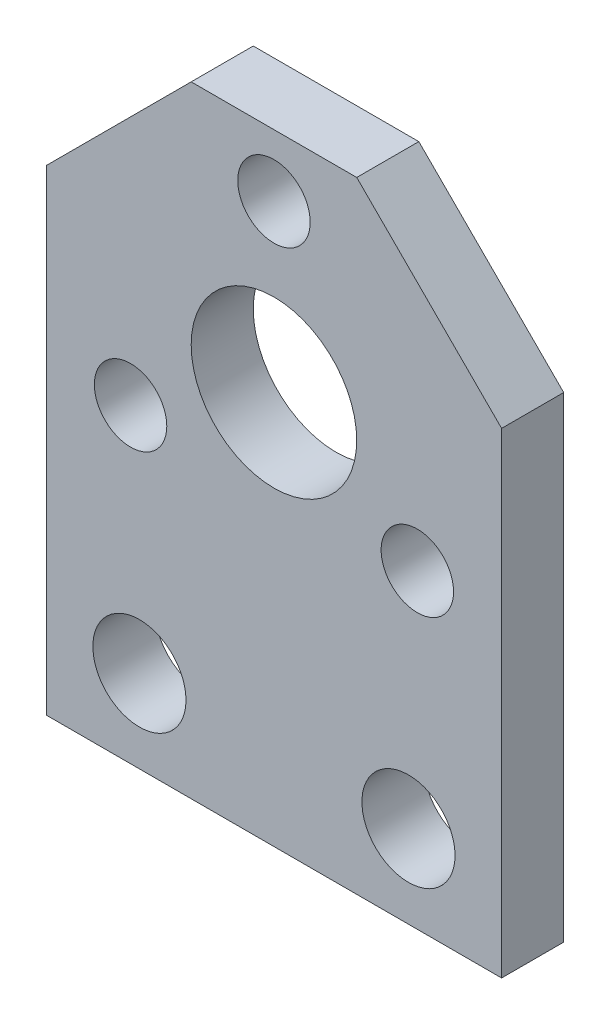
SolidWorks part; units mm, degrees
ref_plane "Plan de face" through (0, 0, 0) normal (0, 0, 1) x (1, 0, 0)
ref_plane "Plan de dessus" through (0, 0, 0) normal (0, 1, 0) x (1, 0, 0)
ref_plane "Plan de droite" through (0, 0, 0) normal (1, 0, 0) x (0, 0, -1)
sketch "Esquisse1" plane through (0, 0, 0) normal (0, 0, 1) x (1, 0, 0)
  line L1 (-11, 11) -> (11, 11)
  line L2 (-11, 11) -> (-11, -19)
  line L3 (-11, -19) -> (11, -19)
  line L4 (11, 11) -> (11, -19)
  circle A0 centre (0, 0) radius 4
  circle A1 centre (0, 8) radius 1.75
  circle A2 centre (6.9282, -4) radius 1.75
  circle A3 centre (-6.9282, -4) radius 1.75
  circle A4 centre (-6.5, -15) radius 2.25
  circle A5 centre (6.5, -15) radius 2.25
  dimension "D5" = 8
  dimension "D6" = 3.5
  dimension "D9" = 4.5
  dimension "D1" = 11
  dimension "D2" = 22
  dimension "D3" = 11
  dimension "D4" = 30
  dimension "D7" = 8
  dimension "D10" = 4
  dimension "D11" = 13
  dimension "D12" = 6.5
  dimension "D8" = 3
extrude "Boss.-Extru.1" add sketch "Esquisse1" along normal blind 3
chamfer "Chanfrein1" distance 7 angle 45 2 edges at (11, 11, 1.5) (-11, 11, 1.5)
